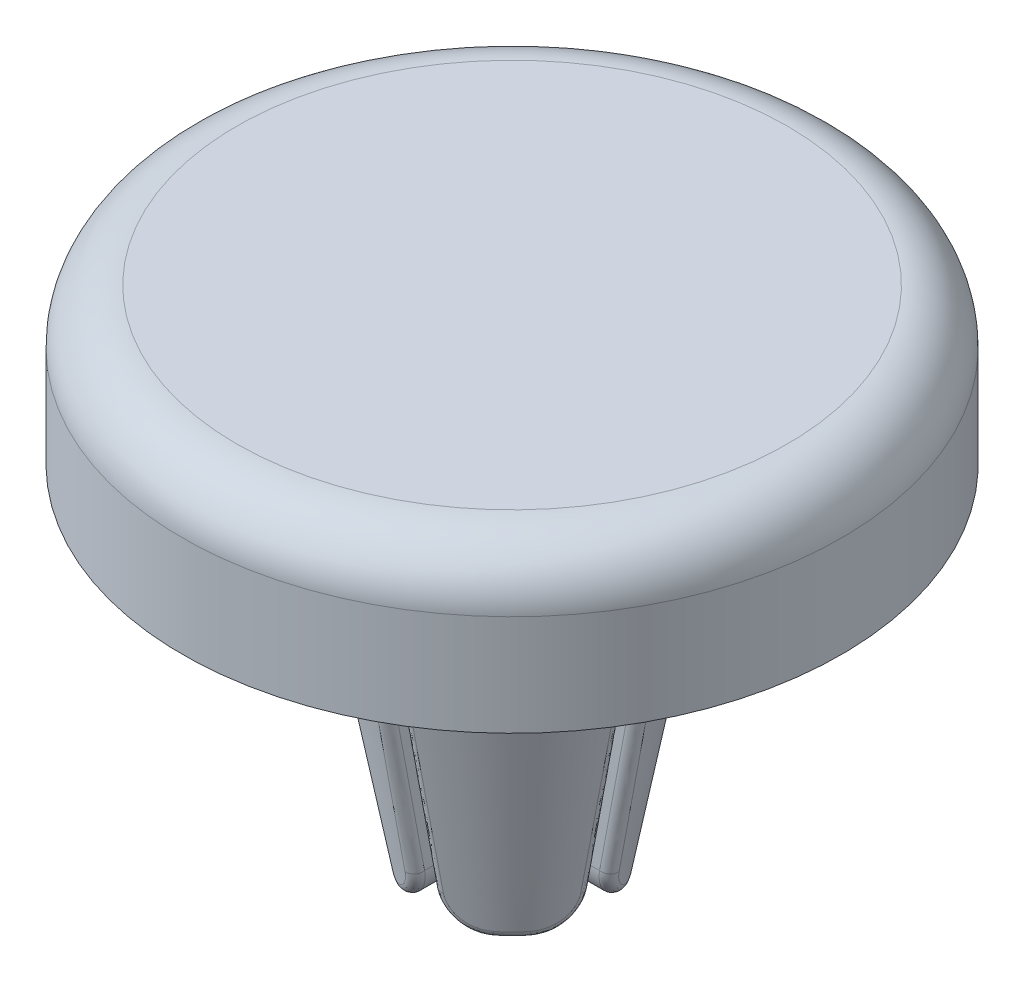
SolidWorks part; units mm, degrees
ref_plane "Front Plane" through (0, 0, 0) normal (0, 0, 1) x (1, 0, 0)
ref_plane "Top Plane" through (0, 0, 0) normal (0, 1, 0) x (1, 0, 0)
ref_plane "Right Plane" through (0, 0, 0) normal (1, 0, 0) x (0, 0, -1)
sketch "Sketch1" plane through (0, 0, 0) normal (0, 0, 1) x (1, 0, 0)
  line L0 (-9.5377, -4.9403) -> (-10.1727, -4.9403)
  line L1 (-10.1727, -4.9403) -> (-10.1727, 0)
  line L2 (-10.1727, 0) -> (-23.1457, 0)
  line L3 (-23.1457, 0) -> (-23.1457, 7.0866)
  line L4 (-19.3357, 10.8966) -> (0, 10.8966)
  line L5 (0, 10.8966) -> (0, 0)
  line L6 (-9.5377, -4.9403) -> (-5.8674, -24.765)
  line L7 (-5.8674, -24.765) -> (0, -24.765)
  line L8 (0, -24.765) -> (0, 0)
  line L9 (0, 10.8966) -> (0, 48.0277) construction
  line L10 (-10.1727, 0) -> (0, 0) construction
  arc A0 (-23.1457, 7.0866) -> (-19.3357, 10.8966) centre (-19.3357, 7.0866) cw
  dimension "D8" = 3.81
  dimension "D1" = 46.2915
  dimension "D2" = 10.8966
  dimension "D3" = 20.3454
  dimension "D4" = 4.9403
  dimension "D5" = 24.765
  dimension "D6" = 11.7348
  dimension "D7" = 0.635
revolve "Revolve1" add sketch "Sketch1" angle 360 about L9
sketch "Sketch2" plane through (0, -24.765, 0) normal (0, -1, 0) x (1, 0, 0)
  line L1 (11.869, -0.584) -> (-11.869, -0.584)
  line L2 (11.869, -0.584) -> (11.869, 0.584)
  line L3 (11.869, 0.584) -> (-11.869, 0.584)
  line L4 (-11.869, -0.584) -> (-11.869, 0.584)
  line L5 (11.869, -0.584) -> (-11.869, 0.584) construction
  line L6 (11.869, 0.584) -> (-11.869, -0.584) construction
  line L7 (-0.584, -11.869) -> (0.584, -11.869)
  line L8 (-0.584, -11.869) -> (-0.584, 11.869)
  line L9 (-0.584, 11.869) -> (0.584, 11.869)
  line L10 (0.584, -11.869) -> (0.584, 11.869)
  line L11 (-0.584, -11.869) -> (0.584, 11.869) construction
  line L12 (-0.584, 11.869) -> (0.584, -11.869) construction
  point P0 (0, 0)
  point P6 (0, 0)
extrude "Cut-Extrude1" cut sketch "Sketch2" against normal up to surface (19.8247 mm away) contours L10 L9 L8 M1 | L4 L1 L3 M1 | L3 L10 L8 M1 | L1 L8 L3 M1 | L1 L10 L3 L8 | L10 L1 L3 M1 | L10 L1 L8 M1 | L7 L10 L8 M1 | L2 L3 L1 M1
fillet "Fillet1" radius 2.54 8 edges at (-0.584, -24.765, 3.2111) (-3.2111, -24.765, 0.584) (0.584, -24.765, 3.2111) (3.2111, -24.765, 0.584) (3.2111, -24.765, -0.584) (0.584, -24.765, -3.2111) (-0.584, -24.765, -3.2111) (-3.2111, -24.765, -0.584)
fillet "Fillet2" radius 0.635 20 edges at (1.4557, -24.1403, -5.8033) (5.9285, -23.8315, -1.1565) (5.8033, -24.1403, 1.4557) (1.1565, -23.8315, 5.9285) (-1.4557, -24.1403, 5.8033) (-5.9285, -23.8315, 1.1565) (-5.8033, -24.1403, -1.4557) (-1.1565, -23.8315, -5.9285) (4.1489, -24.765, -4.1489) (4.1489, -24.765, 4.1489) (-4.1489, -24.765, 4.1489) (-4.1489, -24.765, -4.1489)
sketch "Sketch3" plane through (0, -4.9403, 0) normal (0, -1, 0) x (1, 0, 0)
  circle A0 centre (0, 0) radius 10.1727 construction
  circle A1 centre (0, 0) radius 10.1727
extrude "Cut-Extrude2" [suppressed] cut sketch "Sketch3" along normal through all
